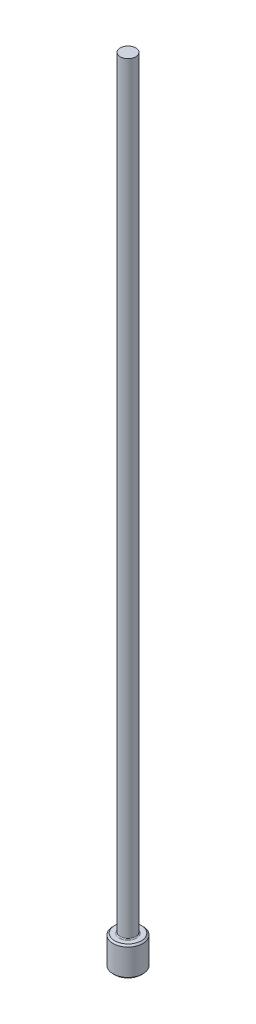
SolidWorks part; units mm, degrees
ref_plane "Front Plane" through (0, 0, 0) normal (0, 0, 1) x (1, 0, 0)
ref_plane "Top Plane" through (0, 0, 0) normal (0, 1, 0) x (1, 0, 0)
ref_plane "Right Plane" through (0, 0, 0) normal (1, 0, 0) x (0, 0, -1)
other "Configuration Table"
sketch "Sketch1" plane through (0, 0, 0) normal (0, 0, 1) x (1, 0, 0)
  line L0 (0, 259.9588) -> (0, -15.1925) construction
  line L1 (0, 0) -> (-1.1938, 0)
  line L2 (-1.1938, 0) -> (-1.1938, 2.3622)
  line L3 (-1.1938, 2.3622) -> (-0.6223, 2.3622)
  line L4 (-0.6223, 2.3622) -> (-0.6223, 63.5)
  line L5 (-0.6223, 63.5) -> (0, 63.5)
  line L6 (0, 63.5) -> (0, 0)
  dimension "L" = 63.5
  dimension "H" = 2.3876
  dimension "T" = 2.3622
  dimension "D" = 1.2446
revolve "Revolve1" add sketch "Sketch1" angle 360 about L0
chamfer "Chamfer1" distance 0.127 angle 45 2 edges at (0, 2.3622, 1.1938) (0, 0, 1.1938)
fillet "Fillet1" radius 0.0762 1 edges at (0, 2.3622, 0.6223)
